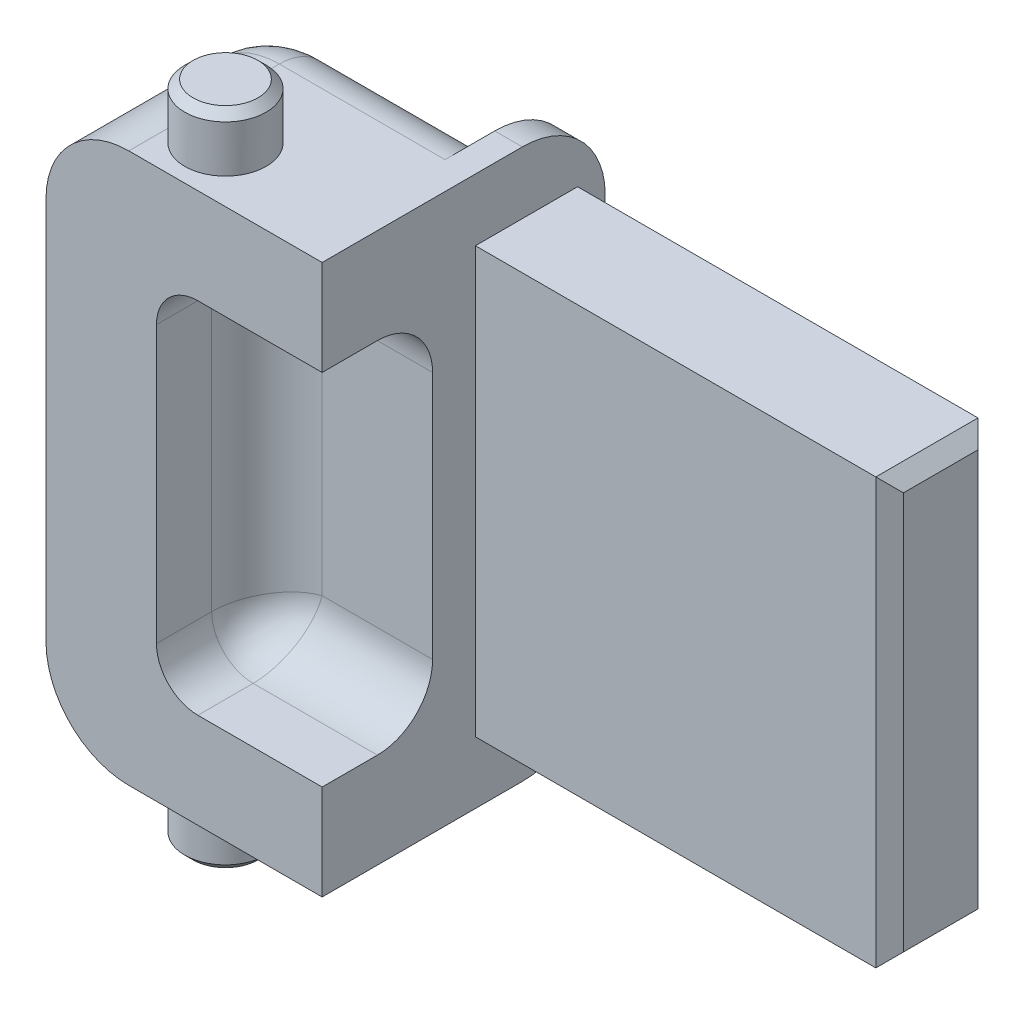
SolidWorks part; units mm, degrees
ref_plane "Plan de face" through (0, 0, 0) normal (0, 0, 1) x (1, 0, 0)
ref_plane "Plan de dessus" through (0, 0, 0) normal (0, 1, 0) x (1, 0, 0)
ref_plane "Plan de droite" through (0, 0, 0) normal (1, 0, 0) x (0, 0, -1)
sketch "Esquisse1" plane through (0, 0, 0) normal (0, 0, 1) x (1, 0, 0)
  line L1 (3, 0) -> (10, 0)
  line L2 (0, 3) -> (0, 16.9)
  line L3 (3, 19.9) -> (10, 19.9)
  line L4 (10, 0) -> (10, 19.9)
  arc A0 (3, 0) -> (0, 3) centre (3, 3) cw
  arc A1 (0, 16.9) -> (3, 19.9) centre (3, 16.9) cw
  point P7 (0, 0)
  point P10 (0, 19.9)
  dimension "D3" = 3
  dimension "D1" = 10
  dimension "D2" = 19.9
extrude "Boss.-Extru.1" add sketch "Esquisse1" along normal blind 7.45
sketch "Esquisse2" plane through (0, 0, 7.45) normal (0, 0, 1) x (1, 0, 0)
  line L0 (0, 16.9) -> (0, 3) construction
  line L1 (5.5, 16.45) -> (13.2904, 16.45)
  line L2 (4, 14.95) -> (4, 4.95)
  line L3 (5.5, 3.45) -> (13.2904, 3.45)
  line L4 (13.2904, 16.45) -> (13.2904, 3.45)
  line L5 (10, 19.9) -> (3, 19.9) construction
  arc A0 (4, 14.95) -> (5.5, 16.45) centre (5.5, 14.95) cw
  arc A1 (4, 4.95) -> (5.5, 3.45) centre (5.5, 4.95) ccw
  dimension "D4" = 1.5
  dimension "D1" = 13
  dimension "D2" = 4
  dimension "D3" = 3.45
extrude "Enlèv. mat.-Extru.1" cut sketch "Esquisse2" against normal blind 4
fillet "Congé1" radius 2 5 edges at (7.75, 16.45, 3.45) (7.75, 3.45, 3.45) (4.4393, 3.8893, 3.45) (4.4393, 16.0107, 3.45) (4, 9.95, 3.45)
fillet "Congé2" radius 2 5 edges at (6.5, 19.9, 0) (0.8787, 19.0213, 0) (0, 9.95, 0) (0.8787, 0.8787, 0) (6.5, 0, 0)
sketch "Esquisse3" plane through (0, 0, 0) normal (0, 0, -1) x (-1, 0, 0)
  line L1 (-10, 22.1683) -> (-9, 22.1683)
  line L2 (-10, 22.1683) -> (-10, -2.8317)
  line L3 (-10, -2.8317) -> (-9, -2.8317)
  line L4 (-9, 22.1683) -> (-9, -2.8317)
  dimension "D1" = 1
  dimension "D2" = 25
extrude "Boss.-Extru.2" add sketch "Esquisse3" along normal mid plane 5.6
sketch "Esquisse4" plane through (0, 0, 0) normal (0, -1, 0) x (1, 0, 0)
  line L0 (3, 7.45) -> (10, 7.45) construction
  line L2 (3, 7.45) -> (3, 2) construction
  line L3 (3, 7.45) -> (12.2887, 7.45)
  line L4 (3, -5.3965) -> (12.2887, -5.3965)
  line L5 (3, 7.45) -> (3, -5.3965)
  line L6 (12.2887, -5.3965) -> (12.2887, 7.45)
extrude "Enlèv. mat.-Extru.3" cut sketch "Esquisse4" along normal blind 10
sketch "Esquisse5" plane through (0, 19.9, 0) normal (0, 1, 0) x (1, 0, 0)
  line L0 (3, 5.2954) -> (10, 5.2954)
  line L6 (9, -2.8) -> (9, -2)
  line L7 (9, -2) -> (3, -2)
  line L8 (3, -2) -> (3, -7.45)
  line L9 (3, -7.45) -> (10, -7.45)
  line L10 (10, -7.45) -> (10, -2.8)
  line L11 (10, -2.8) -> (9, -2.8)
  line L14 (3, 5.2954) -> (3, -7.45)
  line L15 (3, -7.45) -> (10, -7.45)
  line L16 (10, -7.45) -> (10, 5.2954)
  point P8 (9, -1.4184)
  dimension "D1" = 0
extrude "Enlèv. mat.-Extru.4" cut sketch "Esquisse5" along normal blind 10
fillet "Congé3" radius 3 2 edges at (9.5, 19.9, -2.8) (9.5, 0, -2.8)
sketch "Esquisse6" plane through (0, 0, 0) normal (0, -1, 0) x (1, 0, 0)
  line L0 (10, 7.45) -> (10, 0.2) construction
  line L2 (3, 7.45) -> (10, 7.45) construction
  circle A0 centre (4.5, 5.45) radius 1.475
  point P6 (6.1829, 7.45)
  dimension "D1" = 5.5
  dimension "D2" = 2
extrude "Boss.-Extru.3" add sketch "Esquisse6" along normal blind 2
sketch "Esquisse7" plane through (0, 19.9, 0) normal (0, 1, 0) x (1, 0, 0)
  line L0 (10, -7.45) -> (10, -0.2) construction
  line L1 (10, -7.45) -> (3, -7.45) construction
  circle A0 centre (4.5, -5.45) radius 1.475
  dimension "D1" = 5.5
  dimension "D2" = 2
extrude "Boss.-Extru.4" add sketch "Esquisse7" along normal blind 2
chamfer "Chanfrein1" distance 0.3 angle 45 2 edges at (4.5, 21.9, 6.925) (4.5, -2, 3.975)
sketch "Esquisse8" plane through (10, 0, 0) normal (1, 0, 0) x (0, 0, -1)
  line L0 (-7.45, 19.9) -> (-0.2, 19.9) construction
  line L1 (-1.9, 17.65) -> (1.8, 17.65)
  line L2 (-1.9, 17.65) -> (-1.9, 2.25)
  line L3 (-1.9, 2.25) -> (1.8, 2.25)
  line L4 (1.8, 17.65) -> (1.8, 2.25)
  line L5 (2.8, 16.9) -> (2.8, 3) construction
  dimension "D1" = 15.4
  dimension "D2" = 3.7
  dimension "D3" = 2.25
  dimension "D4" = 1
extrude "Boss.-Extru.5" add sketch "Esquisse8" along normal blind 15
chamfer "Chanfrein2" distance 0.5 angle 45 4 edges at (25, 2.25, 0.05) (25, 9.95, 1.9) (25, 17.65, 0.05) (25, 9.95, -1.8)
